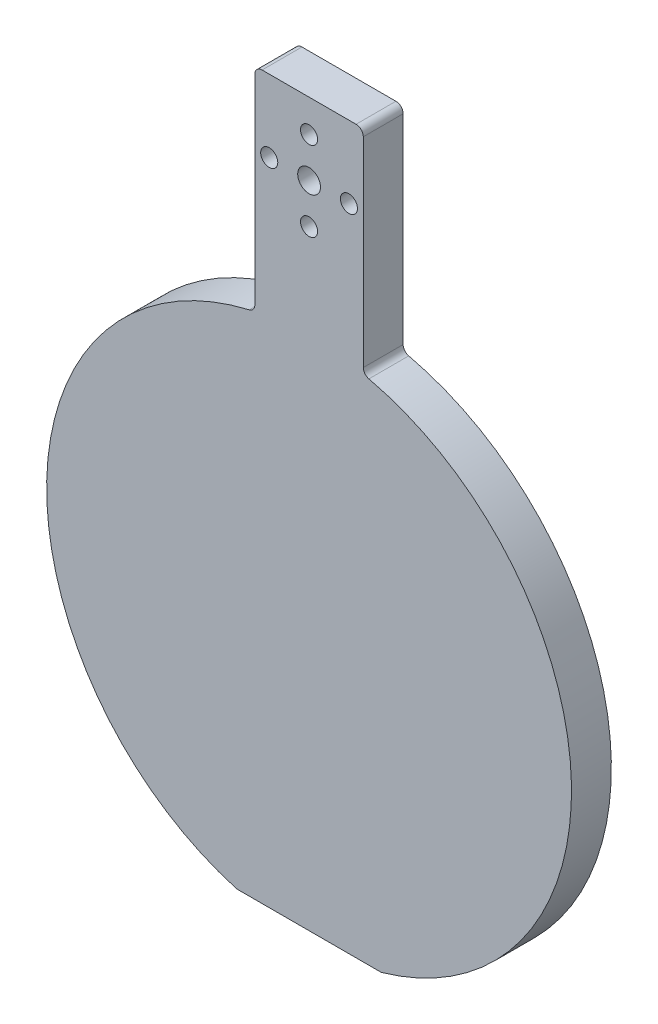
SolidWorks part; units mm, degrees
ref_plane "Front Plane" through (0, 0, 0) normal (0, 0, 1) x (1, 0, 0)
ref_plane "Top Plane" through (0, 0, 0) normal (0, 1, 0) x (1, 0, 0)
ref_plane "Right Plane" through (0, 0, 0) normal (1, 0, 0) x (0, 0, -1)
sketch "Sketch1" plane through (0, 0, 0) normal (0, 0, 1) x (1, 0, 0)
  line L0 (-9.525, 69.8) -> (0, 69.8) construction
  line L2 (-9.525, 46.1246) -> (-9.525, 81.23)
  line L3 (-8.255, 82.5) -> (8.255, 82.5)
  line L4 (9.525, 46.1246) -> (9.525, 81.23)
  line L5 (0, 69.8) -> (9.525, 69.8) construction
  arc A0 (-10.5056, 44.888) -> (10.5056, 44.888) centre (0, 0) ccw
  arc A1 (10.5056, 44.888) -> (9.525, 46.1246) centre (10.795, 46.1246) cw
  arc A2 (8.255, 82.5) -> (9.525, 81.23) centre (8.255, 81.23) cw
  arc A3 (-9.525, 81.23) -> (-8.255, 82.5) centre (-8.255, 81.23) cw
  arc A4 (-10.5056, 44.888) -> (-9.525, 46.1246) centre (-10.795, 46.1246) ccw
  point P1 (0, 69.8)
  point P11 (9.525, 45.1063)
  point P16 (-9.525, 82.5)
  point P19 (-9.525, 45.1063)
  dimension "D1" = 12.7
  dimension "D3" = 92.202
  dimension "D4" = 1.27
  dimension "D2" = 19.05
  dimension "D5" = 69.8
extrude "Boss-Extrude1" add sketch "Sketch1" along normal blind 7
sketch "Sketch2" plane through (0, 0, 7) normal (0, 0, 1) x (1, 0, 0)
  line L1 (0, 69.8) -> (-7, 69.8) construction
  line L2 (7, 69.8) -> (0, 69.8) construction
  line L3 (0, 69.8) -> (0, 62.8) construction
  line L4 (0, 69.8) -> (0, 76.8) construction
  circle A1 centre (0, 69.8) radius 2
  circle A2 centre (0, 62.8) radius 1.5
  circle A3 centre (0, 76.8) radius 1.5
  circle A4 centre (7, 69.8) radius 1.5
  circle A5 centre (-7, 69.8) radius 1.5
  point P15 (0, 69.8)
  dimension "D1" = 4
  dimension "D2" = 3
  dimension "D3" = 14
  dimension "D4" = 14
extrude "Cut-Extrude1" cut sketch "Sketch2" against normal through all both and the other way through all
sketch "Sketch3" plane through (0, 0, 7) normal (0, 0, 1) x (1, 0, 0)
  line L0 (-12.7, -44.3172) -> (12.7, -44.3172)
  line L1 (8.255, 82.5) -> (-8.255, 82.5) construction
  arc A0 (-10.5056, 44.888) -> (10.5056, 44.888) centre (0, 0) ccw construction
  arc A1 (-12.7, -44.3172) -> (12.7, -44.3172) centre (0, 0) ccw
  dimension "D1" = 25.4
extrude "Cut-Extrude2" cut sketch "Sketch3" against normal through all both and the other way through all
sketch "Sketch4" plane through (0, 0, 7) normal (0, 0, 1) x (1, 0, 0)
  point P0 (0, 69.8)
